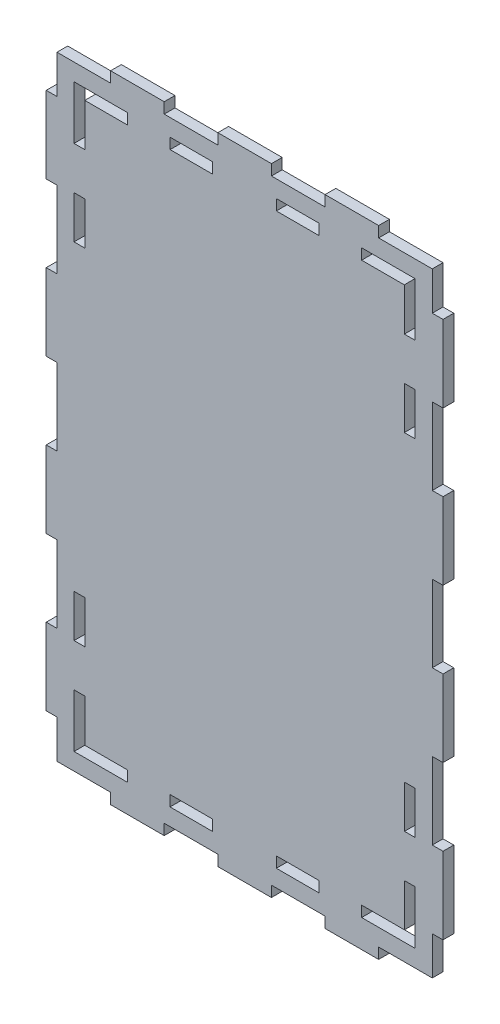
SolidWorks part; units mm, degrees
ref_plane "Front Plane" through (0, 0, 0) normal (0, 0, 1) x (1, 0, 0)
ref_plane "Top Plane" through (0, 0, 0) normal (0, 1, 0) x (1, 0, 0)
ref_plane "Right Plane" through (0, 0, 0) normal (1, 0, 0) x (0, 0, -1)
sketch "Sketch1" plane through (0, 0, 0) normal (0, 0, 1) x (1, 0, 0)
  line L0 (-806.8589, -473.2) -> (-806.8589, -457.2)
  line L1 (-966.5161, 457.2) -> (-886.6875, 457.2)
  line L2 (-966.5161, 457.2) -> (-966.5161, 400.05)
  line L3 (-966.5161, -457.2) -> (-886.6875, -457.2)
  line L4 (-407.7161, 457.2) -> (-407.7161, 400.05)
  line L5 (-806.8589, -457.2) -> (-727.0303, -457.2)
  line L6 (-727.0303, -457.2) -> (-727.0303, -473.2)
  line L7 (-727.0303, -473.2) -> (-647.2018, -473.2)
  line L8 (-886.6875, -457.2) -> (-886.6875, -473.2)
  line L9 (-886.6875, -473.2) -> (-806.8589, -473.2)
  line L10 (-647.2018, -473.2) -> (-647.2018, -457.2)
  line L11 (-647.2018, -457.2) -> (-567.3732, -457.2)
  line L12 (-567.3732, -457.2) -> (-567.3732, -473.2)
  line L13 (-567.3732, -473.2) -> (-487.5446, -473.2)
  line L14 (-487.5446, -473.2) -> (-487.5446, -457.2)
  line L15 (-487.5446, -457.2) -> (-407.7161, -457.2)
  line L16 (-407.7161, 400.05) -> (-391.7161, 400.05)
  line L17 (-698.134, 470.9807) -> (-687.1161, -473.2) construction
  line L18 (-391.7161, 400.05) -> (-391.7161, 285.75)
  line L19 (-966.5161, 285.75) -> (-966.5161, 171.45)
  line L20 (-886.6875, 457.2) -> (-886.6875, 473.2)
  line L21 (-886.6875, 473.2) -> (-806.8589, 473.2)
  line L22 (-806.8589, 473.2) -> (-806.8589, 457.2)
  line L23 (-806.8589, 457.2) -> (-727.0303, 457.2)
  line L24 (-727.0303, 457.2) -> (-727.0303, 473.2)
  line L25 (-727.0303, 473.2) -> (-647.2018, 473.2)
  line L26 (-647.2018, 473.2) -> (-647.2018, 457.2)
  line L27 (-647.2018, 457.2) -> (-567.3732, 457.2)
  line L28 (-567.3732, 457.2) -> (-567.3732, 473.2)
  line L29 (-567.3732, 473.2) -> (-487.5446, 473.2)
  line L30 (-487.5446, 473.2) -> (-487.5446, 457.2)
  line L31 (-487.5446, 457.2) -> (-407.7161, 457.2)
  line L32 (-966.5161, 400.05) -> (-982.5161, 400.05)
  line L33 (-966.5161, 171.45) -> (-982.5161, 171.45)
  line L34 (-966.5161, 285.75) -> (-982.5161, 285.75)
  line L35 (-982.5161, 400.05) -> (-982.5161, 285.75)
  line L36 (-982.5161, 171.45) -> (-982.5161, 57.15)
  line L37 (-982.5161, 57.15) -> (-966.5161, 57.15)
  line L38 (-966.5161, 57.15) -> (-966.5161, -57.15)
  line L39 (-966.5161, -57.15) -> (-982.5161, -57.15)
  line L40 (-982.5161, -57.15) -> (-982.5161, -171.45)
  line L41 (-982.5161, -171.45) -> (-966.5161, -171.45)
  line L42 (-966.5161, -171.45) -> (-966.5161, -285.75)
  line L43 (-966.5161, -285.75) -> (-982.5161, -285.75)
  line L44 (-391.7161, 285.75) -> (-407.7161, 285.75)
  line L45 (-407.7161, 285.75) -> (-407.7161, 171.45)
  line L46 (-407.7161, 171.45) -> (-391.7161, 171.45)
  line L47 (-391.7161, 171.45) -> (-391.7161, 57.15)
  line L48 (-391.7161, 57.15) -> (-407.7161, 57.15)
  line L49 (-407.7161, 57.15) -> (-407.7161, -57.15)
  line L50 (-407.7161, -57.15) -> (-391.7161, -57.15)
  line L51 (-391.7161, -57.15) -> (-391.7161, -171.45)
  line L52 (-391.7161, -171.45) -> (-407.7161, -171.45)
  line L53 (-407.7161, -171.45) -> (-407.7161, -285.75)
  line L54 (-407.7161, -285.75) -> (-391.7161, -285.75)
  line L55 (-391.7161, -285.75) -> (-391.7161, -400.05)
  line L56 (-391.7161, -400.05) -> (-407.7161, -400.05)
  line L57 (-982.5161, -285.75) -> (-982.5161, -400.05)
  line L58 (-982.5161, -400.05) -> (-966.5161, -400.05)
  line L59 (-966.5161, -400.05) -> (-966.5161, -457.2)
  line L60 (-407.7161, -400.05) -> (-407.7161, -457.2)
extrude "Boss-Extrude6" add sketch "Sketch1" along normal blind 16
sketch "Sketch3" plane through (0, 0, 0) normal (0, 0, 1) x (1, 0, 0)
  line L0 (-512.9063, 431.8) -> (-433.3285, 431.8)
  line L1 (-512.9063, 415.8) -> (-449.4063, 415.8)
  line L2 (-861.6161, 415.8) -> (-925.1161, 415.8)
  line L3 (-806.8589, -457.2) -> (-727.0303, -457.2) construction
  line L5 (-433.3285, 431.8) -> (-433.3285, 352.3)
  line L6 (-798.1161, 415.8) -> (-734.6161, 415.8)
  line L7 (-966.5161, -457.2) -> (-886.6875, -457.2) construction
  line L8 (-433.1161, -352.3) -> (-433.1161, -431.8)
  line L9 (-886.6875, 457.2) -> (-966.5161, 457.2) construction
  line L10 (-567.3732, 457.2) -> (-647.2018, 457.2) construction
  line L11 (-727.0303, 457.2) -> (-806.8589, 457.2) construction
  line L13 (-433.1161, -431.8) -> (-512.9063, -431.8)
  line L14 (-449.1161, -352.3) -> (-449.1161, -415.8)
  line L15 (-449.1161, -415.8) -> (-512.9063, -415.8)
  line L16 (-941.1161, -352.3) -> (-941.1161, -431.8)
  line L17 (-941.1161, -431.8) -> (-861.6161, -431.8)
  line L18 (-861.6161, 431.8) -> (-941.1161, 431.8)
  line L19 (-925.1161, -352.3) -> (-925.1161, -415.8)
  line L20 (-925.1161, -415.8) -> (-861.6161, -415.8)
  line L21 (-941.1161, 431.8) -> (-941.1161, 352.3)
  line L22 (-487.5446, -457.2) -> (-407.7161, -457.2) construction
  line L23 (-407.7161, 457.2) -> (-487.5446, 457.2) construction
  line L64 (-925.1161, 415.8) -> (-925.1161, 352.3)
  line L67 (-925.1161, -352.3) -> (-941.1161, -352.3)
  line L70 (-925.1161, 352.3) -> (-941.1161, 352.3)
  line L71 (-941.1161, 288.8) -> (-925.1161, 288.8)
  line L72 (-925.1161, 288.8) -> (-925.1161, 225.3)
  line L73 (-925.1161, 225.3) -> (-941.1161, 225.3)
  line L74 (-941.1161, 288.8) -> (-941.1161, 225.3)
  line L76 (-512.9063, 415.8) -> (-512.9063, 431.8)
  line L77 (-449.4063, 225.3) -> (-433.4063, 225.3)
  line L78 (-433.4064, 288.8) -> (-433.4063, 225.3)
  line L79 (-433.4064, 288.8) -> (-449.4063, 288.8)
  line L80 (-449.4063, 288.8) -> (-449.4063, 225.3)
  line L81 (-576.4063, 415.8) -> (-576.4063, 431.8)
  line L82 (-449.3285, 352.3) -> (-433.3285, 352.3)
  line L83 (-449.4063, 415.8) -> (-449.3285, 352.3)
  line L86 (-576.4063, 431.8) -> (-639.9063, 431.8)
  line L87 (-798.1161, 415.8) -> (-798.1161, 431.8)
  line L91 (-449.1161, -352.3) -> (-433.1161, -352.3)
  line L92 (-449.1161, -288.8) -> (-449.1161, -225.3)
  line L93 (-433.1161, -288.8) -> (-449.1161, -288.8)
  line L94 (-433.1161, -288.8) -> (-433.1161, -225.3)
  line L95 (-449.1161, -225.3) -> (-433.1161, -225.3)
  line L98 (-798.1161, 431.8) -> (-734.6161, 431.8)
  line L99 (-941.1161, -288.8) -> (-925.1181, -288.8)
  line L100 (-941.1161, -288.8) -> (-941.1161, -225.3)
  line L101 (-925.1181, -288.8) -> (-925.1161, -225.3)
  line L102 (-925.1161, -225.3) -> (-941.1161, -225.3)
  line L103 (-734.6161, 431.8) -> (-734.6161, 415.8)
  line L104 (-639.9063, 431.8) -> (-639.9063, 415.8)
  line L105 (-576.4063, 415.8) -> (-639.9063, 415.8)
  line L107 (-861.6161, 415.8) -> (-861.6161, 431.8)
  line L112 (-861.6161, -415.8) -> (-861.6161, -431.8)
  line L114 (-798.1161, -431.8) -> (-734.6161, -431.8)
  line L115 (-798.1161, -415.802) -> (-798.1161, -431.8)
  line L116 (-798.1161, -415.802) -> (-734.6161, -415.8)
  line L117 (-734.6161, -431.8) -> (-734.6161, -415.8)
  line L118 (-576.4063, -431.8) -> (-639.9063, -431.8)
  line L119 (-639.9063, -431.8) -> (-639.9063, -415.8)
  line L120 (-576.4063, -415.802) -> (-639.9063, -415.8)
  line L121 (-576.4063, -415.802) -> (-576.4063, -431.8)
  line L122 (-512.9063, -415.8) -> (-512.9063, -431.8)
  point P3 (-766.3661, -431.8)
  point P6 (-766.9446, -457.2)
  point P19 (-607.2875, 457.2)
  point P20 (-798.1161, 423.8)
  point P21 (-861.6161, 423.8)
  point P24 (-766.9446, 457.2)
extrude "Cut-Extrude16" cut sketch "Sketch3" along normal blind 16.002
equation "\"length\"= 36in"
equation "\"width\"= 22in"
equation "\"D1@Sketch1\"=\"length\""
equation "\"D2@Sketch1\"=\"width\""
equation "\"material thickness\"= 16mm"
equation "\"D3@Sketch1\"=\"width\"/7"
equation "\"D5@Sketch1\"=\"width\"/7"
equation "\"D7@Sketch1\"=\"material thickness\""
equation "\"D9@Sketch1\"=\"length\"/8"
equation "\"D1@Boss-Extrude6\"=\"material thickness\""
equation "\"D10@Sketch3\"=1in"
equation "\"D24@Sketch3\"=\"material thickness\""
equation "\"D25@Sketch3\"=\"material thickness\""
equation "\"D26@Sketch3\"=\"material thickness\""
equation "\"D27@Sketch3\"=\"material thickness\""
equation "\"D28@Sketch3\"=\"material thickness\""
equation "\"D29@Sketch3\"=\"material thickness\""
equation "\"D30@Sketch3\"=\"material thickness\""
equation "\"D31@Sketch3\"=\"material thickness\""
equation "\"D32@Sketch3\"=\"material thickness\""
equation "\"D33@Sketch3\"=\"material thickness\""
equation "\"D34@Sketch3\"=\"material thickness\""
equation "\"D35@Sketch3\"=\"material thickness\""
equation "\"D36@Sketch3\"=\"material thickness\""
equation "\"D4@Sketch1\"=\"material thickness\""
equation "\"D6@Sketch1\"=\"material thickness\""
equation "\"D11@Sketch1\"=\"width\"/7"
equation "\"D12@Sketch1\"=\"width\"/7"
equation "\"D13@Sketch1\"=\"width\"/7"
equation "\"D14@Sketch1\"=\"width\"/7"
equation "\"D15@Sketch1\"=\"width\"/7"
equation "\"D16@Sketch1\"=\"material thickness\""
equation "\"D17@Sketch1\"=\"material thickness\""
equation "\"D18@Sketch1\"=\"material thickness\""
equation "\"D19@Sketch1\"=\"width\"/7"
equation "\"D33@Sketch1\"=\"material thickness\""
equation "\"D32@Sketch1\"=\"length\"/16"
equation "\"D34@Sketch1\"=\"length\"/8"
equation "\"D35@Sketch1\"=\"material thickness\""
equation "\"D36@Sketch1\"=\"length\"/8"
equation "\"D37@Sketch1\"=\"length\"/8"
equation "\"D38@Sketch1\"=\"length\"/8"
equation "\"D39@Sketch1\"=\"length\"/8"
equation "\"D40@Sketch1\"=\"length\"/8"
equation "\"D41@Sketch1\"=\"length\"/8"
equation "\"D42@Sketch1\"=\"length\"/16"
equation "\"D43@Sketch1\"=\"material thickness\""
equation "\"D44@Sketch1\"=\"material thickness\""
equation "\"D45@Sketch1\"=\"material thickness\""
equation "\"D46@Sketch1\"=\"material thickness\""
equation "\"D47@Sketch1\"=\"material thickness\""
equation "\"D48@Sketch1\"=\"material thickness\""
equation "\"D8@Sketch1\"=\"length\"/16"
equation "\"D10@Sketch1\"=\"length\"/8"
equation "\"D49@Sketch1\"=\"length\"/8"
equation "\"D50@Sketch1\"=\"length\"/8"
equation "\"D51@Sketch1\"=\"length\"/8"
equation "\"D52@Sketch1\"=\"length\"/8"
equation "\"D53@Sketch1\"=\"length\"/8"
equation "\"D54@Sketch1\"=\"length\"/16"
equation "\"D21@Sketch1\"=\"width\"/7"
equation "\"D22@Sketch1\"=\"width\"/7"
equation "\"D23@Sketch1\"=\"width\"/7"
equation "\"D24@Sketch1\"=\"width\"/7"
equation "\"D25@Sketch1\"=\"width\"/7"
equation "\"D20@Sketch1\"=\"material thickness\""
equation "\"D26@Sketch1\"=\"material thickness\""
equation "\"D27@Sketch1\"=\"material thickness\""
equation "\"D28@Sketch1\"=\"material thickness\""
equation "\"D29@Sketch1\"=\"material thickness\""
